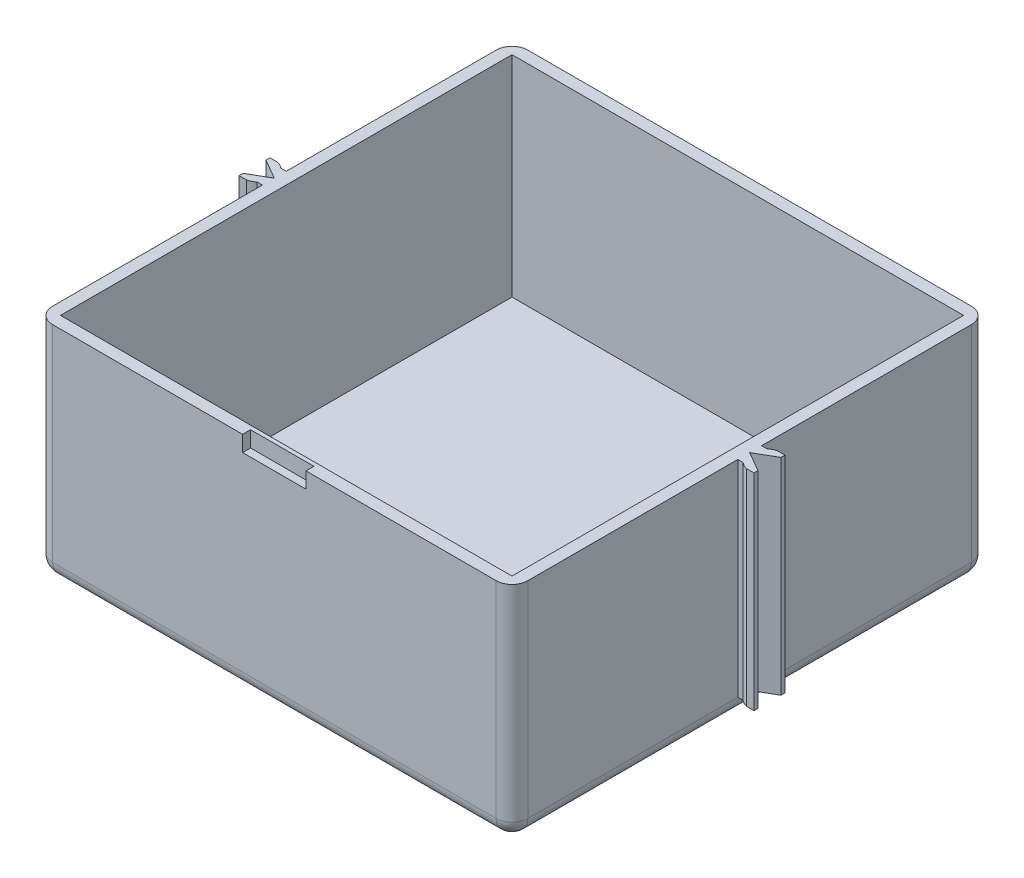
SolidWorks part; units mm, degrees
ref_plane "前视基准面" through (0, 0, 0) normal (0, 0, 1) x (1, 0, 0)
ref_plane "上视基准面" through (0, 0, 0) normal (0, 1, 0) x (1, 0, 0)
ref_plane "右视基准面" through (0, 0, 0) normal (1, 0, 0) x (0, 0, -1)
sketch "草图1" plane through (0, 0, 0) normal (0, 1, 0) x (1, 0, 0)
  line L0 (30, 30) -> (30, -30)
  line L1 (30, 30) -> (-30, 30)
  line L2 (30, -30) -> (-30, -30)
  line L3 (-30, 30) -> (-30, -30)
  line L4 (30, 30) -> (-30, -30) construction
  line L5 (30, -30) -> (-30, 30) construction
  point P1 (0, 0)
  dimension "D1" = 60
  dimension "D2" = 60
extrude "凸台-拉伸1" add sketch "草图1" along normal blind 28
sketch "草图2" plane through (0, 28, 0) normal (0, 1, 0) x (1, 0, 0)
  line L8 (28.5, 28.5) -> (-28.5, 28.5)
  line L9 (-28.5, 28.5) -> (-28.5, -28.5)
  line L10 (-28.5, -28.5) -> (28.5, -28.5)
  line L11 (28.5, -28.5) -> (28.5, 28.5)
  line L12 (28.5, 28.5) -> (-28.5, 28.5)
  line L13 (-28.5, 28.5) -> (-28.5, -28.5)
  line L14 (-28.5, -28.5) -> (28.5, -28.5)
  line L15 (28.5, -28.5) -> (28.5, 28.5)
  dimension "D1" = 1.5
extrude "切除-拉伸1" cut sketch "草图2" against normal blind 26.5
sketch "草图3" plane through (0, 28, 0) normal (0, 1, 0) x (1, 0, 0)
  line L0 (-30, 0) -> (-32, 0) construction
  line L2 (-30, 30) -> (-30, -30) construction
  line L3 (-32, 0) -> (-32.5, 0) construction
  line L4 (-30, 0) -> (-30, -1.5)
  line L5 (-30, -1.5) -> (-30.6771, -1.5)
  line L6 (-32.5, -1.4434) -> (-32.5, -1.95)
  line L7 (-32.5, -1.95) -> (-31.5556, -1.95)
  line L8 (-30, 0) -> (-32.5, -1.4434)
  line L9 (-32.5, 0) -> (-32.5, -1.4434) construction
  arc A0 (-31.5556, -1.95) -> (-30.6771, -1.5) centre (-32, 0) ccw
  dimension "D5" = 2
  dimension "D1" = 2
  dimension "D2" = 0.5
  dimension "D3" = 1.5
  dimension "D4" = 1.95
  dimension "D6" = 30
extrude "凸台-拉伸3" add sketch "草图3" against normal blind 26
mirror "镜向4" about plane through (0, 0, 0) normal (0, 0, 1) of "凸台-拉伸3"
mirror "镜向5" about plane through (0, 0, 0) normal (1, 0, 0) of "凸台-拉伸3", "镜向4"
sketch "草图4" plane through (0, 28, 0) normal (0, 1, 0) x (1, 0, 0)
  line L0 (0, 0) -> (0, -30) construction
  line L1 (-30, -30) -> (30, -30) construction
  line L2 (4, -29) -> (4, -31)
  line L3 (4, -29) -> (-4, -29)
  line L4 (4, -31) -> (-4, -31)
  line L5 (-4, -29) -> (-4, -31)
  line L6 (4, -29) -> (-4, -31) construction
  line L7 (4, -31) -> (-4, -29) construction
  dimension "D1" = 8
  dimension "D2" = 2
extrude "切除-拉伸2" cut sketch "草图4" against normal blind 2
fillet "圆角1" radius 2 8 edges at (-30, 0, 0) (0, 0, 30) (30, 0, 0) (0, 0, -30) (30, 14, 30) (-30, 14, 30) (30, 14, -30) (-30, 14, -30)
